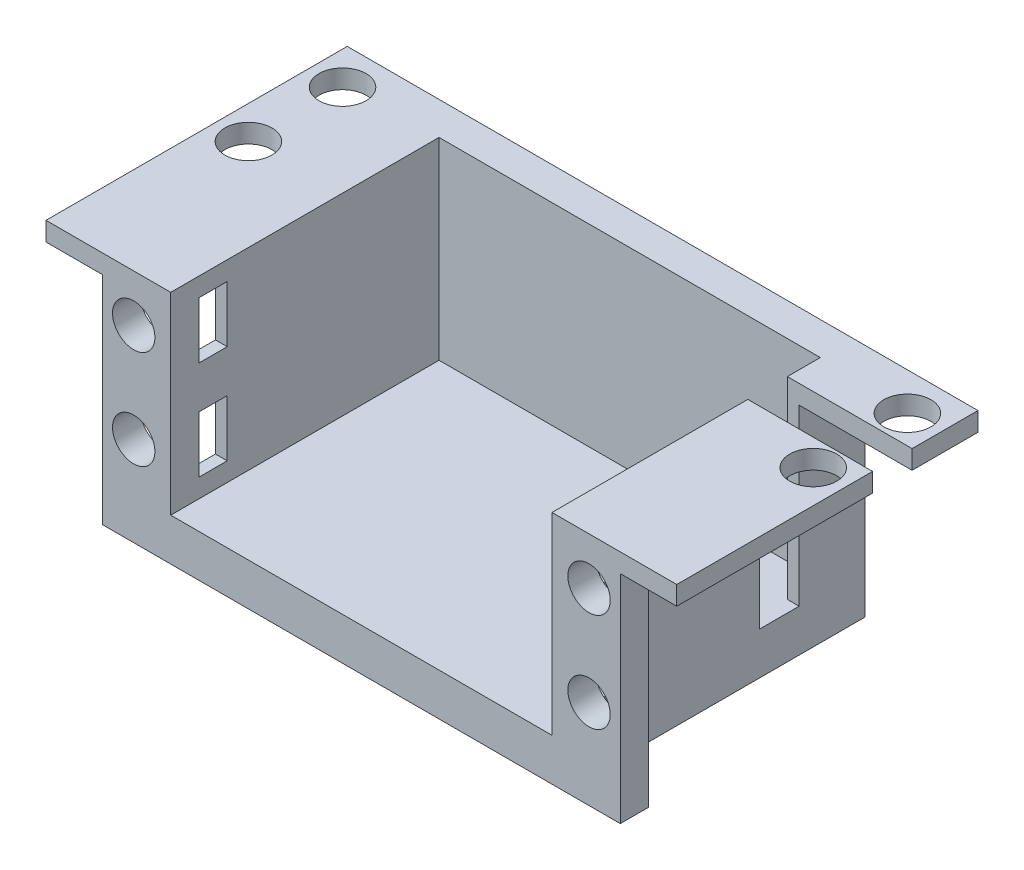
SolidWorks part; units mm, degrees
ref_plane "Front Plane" through (0, 0, 0) normal (0, 0, 1) x (1, 0, 0)
ref_plane "Top Plane" through (0, 0, 0) normal (0, 1, 0) x (1, 0, 0)
ref_plane "Right Plane" through (0, 0, 0) normal (1, 0, 0) x (0, 0, -1)
sketch "Sketch1" plane through (0, 0, 0) normal (0, 1, 0) x (1, 0, 0)
  line L1 (0, 0) -> (55, 0)
  line L2 (0, 0) -> (0, 32)
  line L3 (0, 32) -> (55, 32)
  line L4 (55, 0) -> (55, 32)
  dimension "D1" = 55
  dimension "D2" = 32
extrude "Boss-Extrude1" add sketch "Sketch1" along normal blind 25
sketch "Sketch2" plane through (0, 25, 0) normal (0, 1, 0) x (1, 0, 0)
  line L0 (0, 32) -> (55, 0) construction
  line L1 (0, 0) -> (55, 32) construction
  line L2 (0, 32) -> (0, 0) construction
  line L3 (-6, 32) -> (61, 32)
  line L4 (-6, 32) -> (-6, 0)
  line L5 (-6, 0) -> (61, 0)
  line L6 (61, 32) -> (61, 0)
  line L7 (-6, 32) -> (61, 0) construction
  line L8 (-6, 0) -> (61, 32) construction
  point P8 (27.5, 16)
  point P15 (0, 0)
  dimension "D1" = 6
extrude "Boss-Extrude2" add sketch "Sketch2" against normal blind 2
sketch "Sketch4" plane through (0, 25, 0) normal (0, 1, 0) x (1, 0, 0)
  line L0 (61, 32) -> (-6, 32) construction
  line L1 (7.25, 0) -> (47.75, 0)
  line L2 (7.25, 0) -> (7.25, 28.5)
  line L3 (7.25, 28.5) -> (47.75, 28.5)
  line L4 (47.75, 0) -> (47.75, 28.5)
  line L5 (-6, 0) -> (61, 0) construction
  point P7 (27.5, 32)
  point P8 (27.5, 28.5)
  point P9 (0, 0)
  dimension "D1" = 28.5
  dimension "D2" = 40.5
extrude "Cut-Extrude1" cut sketch "Sketch4" against normal blind 20.5
sketch "Sketch5" plane through (0, 0, 0) normal (0, 0, 1) x (1, 0, 0)
  line L0 (27.5, -4.2585) -> (27.5, 30.6254) construction
  line L1 (51.6844, -5.3653) -> (51.6844, 30.3397) construction
  line L2 (0, 0) -> (55, 0) construction
  line L3 (47.75, 25) -> (61, 25) construction
  line L4 (7.25, 4.5) -> (47.75, 4.5) construction
  circle A0 centre (51.6844, 20) radius 2.25
  circle A1 centre (51.6844, 9.5) radius 2.25
  circle A2 centre (3.3156, 20) radius 2.25
  circle A3 centre (3.3156, 9.5) radius 2.25
  point P6 (27.5, 0)
  dimension "D1" = 4.5
  dimension "D2" = 5
  dimension "D3" = 5
extrude "Cut-Extrude2" cut sketch "Sketch5" against normal through all
sketch "Sketch6" plane through (0, 25, 0) normal (0, 1, 0) x (1, 0, 0)
  line L0 (27.5, 0) -> (27.5, 28.5) construction
  line L1 (7.25, 0) -> (47.75, 0) construction
  line L2 (47.75, 28.5) -> (7.25, 28.5) construction
  line L3 (-6, 0) -> (7.25, 0) construction
  circle A0 centre (-2.5, 28) radius 2.5
  circle A1 centre (-2.5, 18) radius 2.5
  circle A2 centre (57.5, 18) radius 2.5
  circle A3 centre (57.5, 28) radius 2.5
  dimension "D1" = 5
  dimension "D2" = 10
  dimension "D3" = 18
  dimension "D4" = 60
extrude "Cut-Extrude8" cut sketch "Sketch6" against normal through all
sketch "Sketch7" plane through (0, 0, -32) normal (0, 0, -1) x (-1, 0, 0)
  line L0 (-61, 23) -> (-55, 23) construction
  line L1 (-55, 0) -> (-49, 0)
  line L2 (-55, 0) -> (-55, 23)
  line L3 (-55, 23) -> (-49, 23)
  line L4 (-49, 0) -> (-49, 23)
  line L5 (0, 0) -> (-6, 0)
  line L6 (0, 0) -> (0, 23)
  line L7 (0, 23) -> (-6, 23)
  line L8 (-6, 0) -> (-6, 23)
  dimension "D1" = 6
  dimension "D2" = 6
extrude "Cut-Extrude9" cut sketch "Sketch7" against normal offset from surface (29 mm away) 3
sketch "Sketch8" plane through (49, 0, 0) normal (1, 0, 0) x (0, 0, -1)
  line L0 (3, 23) -> (3, 0) construction
  line L1 (3, 12.5) -> (6, 12.5)
  line L2 (3, 12.5) -> (3, 6.5)
  line L3 (3, 6.5) -> (6, 6.5)
  line L4 (6, 12.5) -> (6, 6.5)
  line L5 (0, 25) -> (32, 25) construction
  line L6 (3, 23) -> (6, 23)
  line L7 (3, 23) -> (3, 17)
  line L8 (3, 17) -> (6, 17)
  line L9 (6, 23) -> (6, 17)
  dimension "D1" = 6
  dimension "D2" = 6
  dimension "D3" = 3
  dimension "D4" = 3
  dimension "D5" = 2
  dimension "D6" = 12.5
extrude "Cut-Extrude10" cut sketch "Sketch8" against normal through all both and the other way through all
sketch "Sketch9" plane through (0, 25, 0) normal (0, 1, 0) x (1, 0, 0)
  line L0 (47.75, 0) -> (47.75, 28.5) construction
  line L1 (47.75, 25) -> (61, 25)
  line L2 (47.75, 25) -> (47.75, 20.8)
  line L3 (47.75, 20.8) -> (61, 20.8)
  line L4 (61, 25) -> (61, 20.8)
  line L5 (61, 0) -> (61, 32) construction
  line L7 (47.75, 28.5) -> (7.25, 28.5) construction
  dimension "D1" = 4.2
  dimension "D2" = 3.5
extrude "Cut-Extrude11" cut sketch "Sketch9" against normal up to surface (20.5 mm away) and the other way through all
